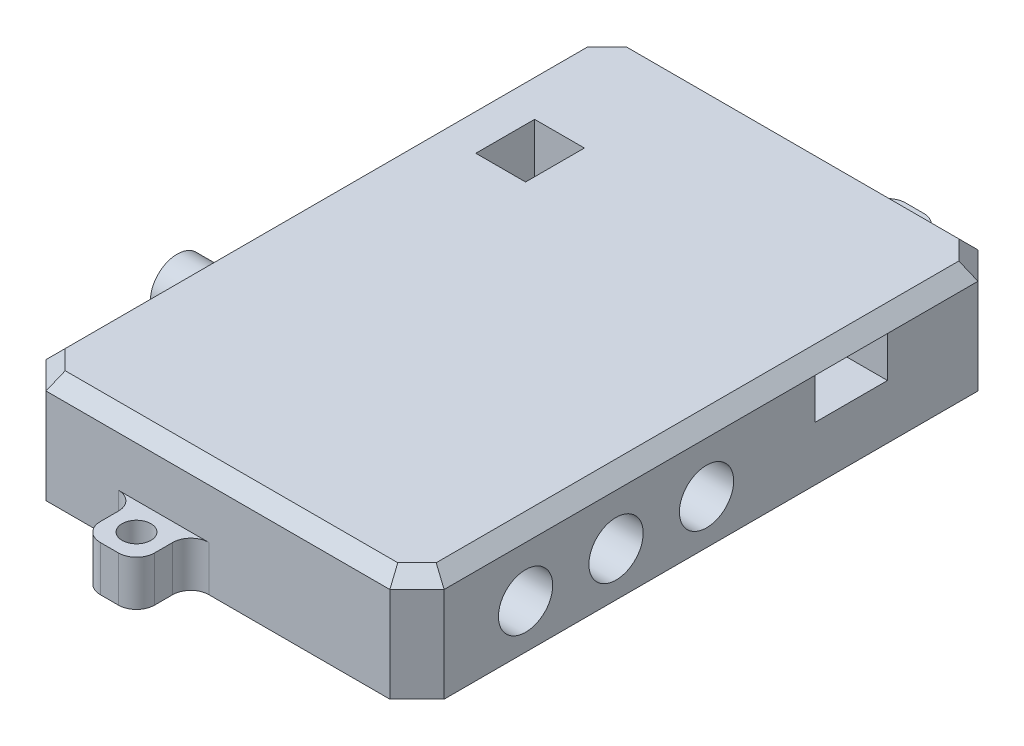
SolidWorks part; units mm, degrees
ref_plane "前视" through (0, 0, 0) normal (0, 0, 1) x (1, 0, 0)
ref_plane "上视" through (0, 0, 0) normal (0, 1, 0) x (1, 0, 0)
ref_plane "右视" through (0, 0, 0) normal (1, 0, 0) x (0, 0, -1)
sketch "草图1" plane through (0, 0, 0) normal (0, 1, 0) x (1, 0, 0)
  line L1 (-22, 32.5) -> (22, 32.5)
  line L2 (-22, 32.5) -> (-22, -32.5)
  line L3 (-22, -32.5) -> (22, -32.5)
  line L4 (22, 32.5) -> (22, -32.5)
  line L5 (-22, 32.5) -> (22, -32.5) construction
  line L6 (-22, -32.5) -> (22, 32.5) construction
  point P0 (0, 0)
  dimension "D1" = 65
  dimension "D2" = 44
extrude "凸台-拉伸1" add sketch "草图1" along normal blind 12
chamfer "倒角1" distance 3 angle 45 4 edges at (-22, 6, -32.5) (22, 6, -32.5) (22, 6, 32.5) (-22, 6, 32.5)
chamfer "倒角2" distance 1.5 angle 45 8 edges at (20.5, 12, -31) (22, 12, 0) (20.5, 12, 31) (0, 12, 32.5) (-20.5, 12, 31) (-22, 12, 0) (-20.5, 12, -31) (0, 12, -32.5)
sketch "草图2" plane through (0, 0, 0) normal (0, -1, 0) x (1, 0, 0)
  line L0 (-19, 32.5) -> (19, 32.5) construction
  line L1 (-9, 32.5) -> (-3, 32.5)
  line L2 (-9, 32.5) -> (-9, 38.5)
  line L3 (-9, 38.5) -> (-3, 38.5)
  line L4 (-3, 32.5) -> (-3, 38.5)
  line L5 (19, -32.5) -> (-19, -32.5) construction
  line L6 (3, -32.5) -> (9, -32.5)
  line L7 (3, -32.5) -> (3, -38.5)
  line L8 (3, -38.5) -> (9, -38.5)
  line L9 (9, -32.5) -> (9, -38.5)
  line L10 (-22, -29.5) -> (-22, 29.5) construction
  line L11 (22, 29.5) -> (22, -29.5) construction
  line L12 (-6, 38.5) -> (-6, 32.5) construction
  line L13 (6, -38.5) -> (6, -32.5) construction
  circle A0 centre (-6, 35.5) radius 1.6
  circle A1 centre (6, -35.5) radius 1.6
  dimension "D7" = 3.2
  dimension "D1" = 6
  dimension "D2" = 6
  dimension "D3" = 6
  dimension "D4" = 6
  dimension "D5" = 13
  dimension "D6" = 13
extrude "凸台-拉伸2" add sketch "草图2" against normal blind 5
fillet "圆角1" radius 2 4 edges
fillet "圆角2" radius 2 4 edges at (9, 2.5, -38.5) (3, 2.5, -38.5) (-3, 2.5, 38.5) (-9, 2.5, 38.5)
sketch "草图3" plane through (22, 0, 0) normal (1, 0, 0) x (0, 0, -1)
  line L0 (-32.5, 0) -> (-32.5, 10.5) construction
  circle A0 centre (-20.5, 4.9007) radius 3
  circle A1 centre (-10.5, 4.9007) radius 3
  circle A2 centre (-0.5, 4.9007) radius 3
  dimension "D1" = 6
  dimension "D2" = 12
  dimension "D3" = 10
  dimension "D4" = 10
extrude "切除-拉伸1" cut sketch "草图3" against normal blind 5
sketch "草图4" plane through (-22, 0, 0) normal (-1, 0, 0) x (0, 0, 1)
  line L0 (32.5, 10.5) -> (32.5, 0) construction
  circle A0 centre (10, 5.3893) radius 2.964
  dimension "D1" = 22.5
extrude "凸台-拉伸3" add sketch "草图4" along normal blind 5
sketch "草图5" plane through (0, 0, 0) normal (0, -1, 0) x (1, 0, 0)
  line L0 (1, -32.5) -> (-19, -32.5) construction
  line L1 (-16.5, -19) -> (-11, -19)
  line L2 (-16.5, -19) -> (-16.5, -12.5)
  line L3 (-16.5, -12.5) -> (-11, -12.5)
  line L4 (-11, -19) -> (-11, -12.5)
  line L5 (-22, -29.5) -> (-22, 29.5) construction
  dimension "D1" = 13.5
  dimension "D2" = 20
  dimension "D3" = 5.5
  dimension "D4" = 11
extrude "切除-拉伸2" cut sketch "草图5" against normal through all
sketch "草图6" plane through (22, 0, 0) normal (1, 0, 0) x (0, 0, -1)
  line L0 (32.5, 10.5) -> (32.5, 0) construction
  line L1 (11.5, 10.5) -> (19.5, 10.5)
  line L2 (11.5, 10.5) -> (11.5, 6)
  line L3 (11.5, 6) -> (19.5, 6)
  line L4 (19.5, 10.5) -> (19.5, 6)
  line L5 (-28.8787, 12) -> (28.8787, 12) construction
  dimension "D1" = 13
  dimension "D2" = 1.5
  dimension "D3" = 8
  dimension "D4" = 4.5
extrude "切除-拉伸3" cut sketch "草图6" against normal blind 5
